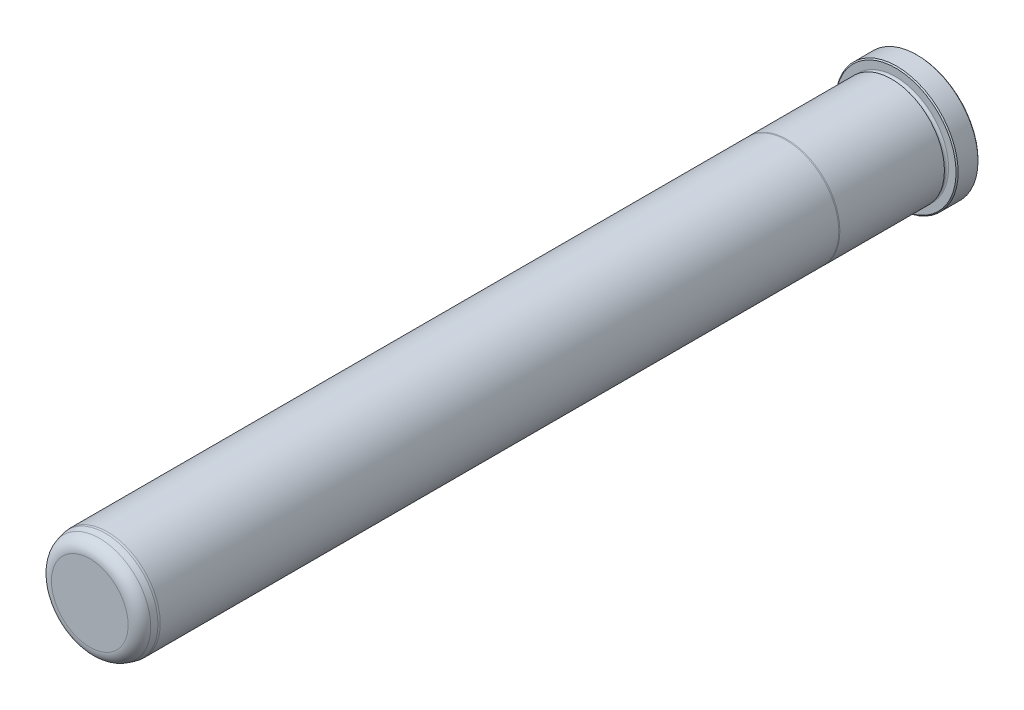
SolidWorks part; units mm, degrees
ref_plane "Front Plane" through (0, 0, 0) normal (0, 0, 1) x (1, 0, 0)
ref_plane "Top Plane" through (0, 0, 0) normal (0, 1, 0) x (1, 0, 0)
ref_plane "Right Plane" through (0, 0, 0) normal (1, 0, 0) x (0, 0, -1)
sketch "Sketch1" plane through (0, 0, 0) normal (1, 0, 0) x (0, 0, -1)
  line L0 (0, 0) -> (0, 22.098)
  line L1 (0, 22.098) -> (-7.9248, 22.098)
  line L2 (-7.9248, 22.098) -> (-7.9248, 19.0373)
  line L3 (-7.9248, 18.2753) -> (-9.4488, 18.2753) construction
  line L4 (-9.4488, 19.0373) -> (-9.4488, 19.0627)
  line L5 (-9.4488, 19.0627) -> (-47.1348, 19.0627)
  line L6 (-47.1348, 19.0627) -> (-47.498, 19.0373)
  line L7 (-47.498, 19.0373) -> (-292.1, 19.0373)
  line L9 (-298.45, 17.4733) -> (-298.45, 0)
  line L10 (-298.45, 0) -> (0, 0)
  line L11 (0, 0) -> (13.6287, 0) construction
  line L12 (-292.1, 19.0373) -> (-292.862, 18.9706)
  line L13 (-292.862, 18.9706) -> (-298.45, 17.4733)
  arc A0 (-9.4488, 19.0373) -> (-7.9248, 19.0373) centre (-8.6868, 19.0373) ccw
  dimension "D14" = 1.524
  dimension "D1" = 7.9248
  dimension "D2" = 1.524
  dimension "D3" = 44.196
  dimension "D4" = 38.1254
  dimension "D5" = 47.498
  dimension "D6" = 298.45
  dimension "D7" = 0.7874
  dimension "D8" = 4
  dimension "D9" = 38.0746
  dimension "D10" = 5
  dimension "D11" = 15
  dimension "D12" = 0.762
  dimension "D13" = 6.35
revolve "Revolve1" add sketch "Sketch1" angle 360 about L11
fillet "Fillet6" radius 4.7625 1 edges at (17.4733, 0, 298.45)
chamfer "Chamfer1" distance 0.381 angle 45 2 edges at (22.098, 0, 0) (22.098, 0, 7.9248)
